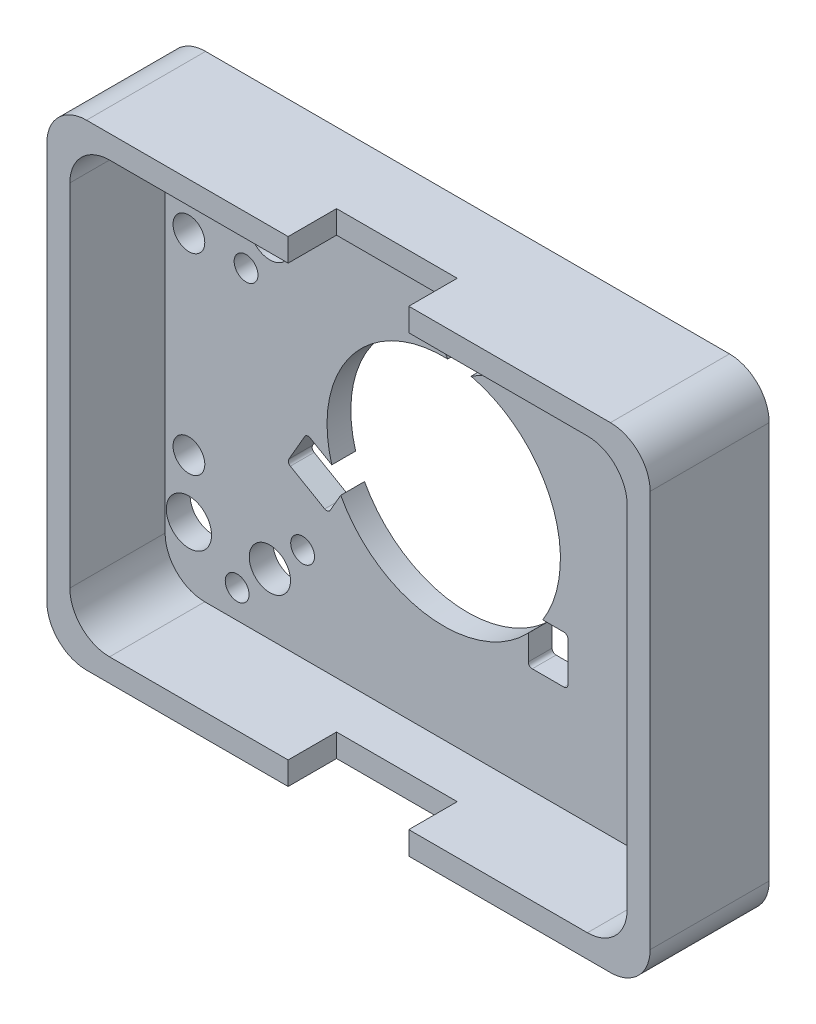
SolidWorks part; units mm, degrees
ref_plane "前基準面" through (0, 0, 0) normal (0, 0, 1) x (1, 0, 0)
ref_plane "上基準面" through (0, 0, 0) normal (0, 1, 0) x (1, 0, 0)
ref_plane "右基準面" through (0, 0, 0) normal (1, 0, 0) x (0, 0, -1)
sketch "草圖1" plane through (0, 0, 0) normal (0, 0, 1) x (1, 0, 0)
  line L1 (-33, 30) -> (33, 30)
  line L2 (-38, 25) -> (-38, -25)
  line L3 (-33, -30) -> (33, -30)
  line L4 (38, 25) -> (38, -25)
  line L5 (-38, 30) -> (38, -30) construction
  line L6 (-38, -30) -> (38, 30) construction
  arc A0 (-38, -25) -> (-33, -30) centre (-33, -25) ccw
  arc A1 (33, -30) -> (38, -25) centre (33, -25) ccw
  arc A2 (33, 30) -> (38, 25) centre (33, 25) cw
  arc A3 (-33, 30) -> (-38, 25) centre (-33, 25) ccw
  point P0 (0, 0)
  dimension "D3" = 5
  dimension "D1" = 76
  dimension "D2" = 60
extrude "填料-伸長1" add sketch "草圖1" along normal blind 15
sketch "草圖2" plane through (0, 0, 15) normal (0, 0, 1) x (1, 0, 0)
  line L0 (33, 30) -> (-33, 30) construction
  line L1 (-30.1, 27.1) -> (30.1, 27.1)
  line L2 (-35.1, 22.1) -> (-35.1, -22.1)
  line L3 (-30.1, -27.1) -> (30.1, -27.1)
  line L4 (35.1, 22.1) -> (35.1, -22.1)
  line L5 (-35.1, 27.1) -> (35.1, -27.1) construction
  line L6 (-35.1, -27.1) -> (35.1, 27.1) construction
  line L8 (-38, 25) -> (-38, -25) construction
  arc A0 (-35.1, -22.1) -> (-30.1, -27.1) centre (-30.1, -22.1) ccw
  arc A1 (30.1, -27.1) -> (35.1, -22.1) centre (30.1, -22.1) ccw
  arc A2 (30.1, 27.1) -> (35.1, 22.1) centre (30.1, 22.1) cw
  arc A3 (-30.1, 27.1) -> (-35.1, 22.1) centre (-30.1, 22.1) ccw
  point P0 (0, 0)
  dimension "D3" = 5
  dimension "D1" = 2.9
  dimension "D2" = 2.9
extrude "除料-伸長1" cut sketch "草圖2" against normal blind 12
sketch "草圖3" plane through (0, 0, 0) normal (0, 1, 0) x (1, 0, 0)
  line L0 (0, 11.6056) -> (0, -27.4941) construction
  line L1 (0, -3) -> (14.7, -3)
  line L2 (30.1, -3) -> (-30.1, -3) construction
  line L3 (14.7, -3) -> (14.7, -1.9)
  line L6 (0, -1.9) -> (0, -3)
  line L7 (14.7, -1.9) -> (14.7, 0)
  line L8 (33, 0) -> (-33, 0) construction
  line L9 (14.7, 0) -> (0, 0)
  line L10 (0, 0) -> (0, -1.9)
  dimension "D1" = 14.7
  dimension "D2" = 14.7
  dimension "D3" = 1.1
revolve "除料-旋轉1" cut sketch "草圖3" angle 360 about L0
ref_plane "平面1" through (0, 0, 15) normal (0, 0, 1) x (1, 0, 0)
sketch "草圖4" plane through (0, 0, 15) normal (0, 0, 1) x (1, 0, 0)
  line L0 (0, 32.9941) -> (0, -32.6269) construction
  line L1 (-42.1259, 0) -> (41.8506, 0) construction
  line L2 (7.6, 30) -> (-7.6, 30)
  line L3 (33, 30) -> (-33, 30) construction
  line L4 (-7.6, 30) -> (-7.6, 27.1)
  line L5 (30.1, 27.1) -> (-30.1, 27.1) construction
  line L6 (-7.6, 27.1) -> (7.6, 27.1)
  line L7 (30.1, 27.1) -> (-30.1, 27.1) construction
  line L8 (0, 27.1) -> (0, 30)
  line L9 (7.6, 30) -> (7.6, 27.1)
  line L10 (-7.6, -30) -> (-7.6, -27.1)
  line L11 (7.6, -30) -> (-7.6, -30)
  line L12 (7.6, -30) -> (7.6, -27.1)
  line L13 (-7.6, -27.1) -> (7.6, -27.1)
  dimension "D1" = 7.6
extrude "除料-伸長2" cut sketch "草圖4" against normal blind 6.1 contours L6 L9 L2 L4 | L11 L10 L13 L12
sketch "草圖5" plane through (0, 0, 3) normal (0, 0, 1) x (1, 0, 0)
  line L0 (0, 27.1) -> (0, -27.1) construction
  line L1 (30.1, 27.1) -> (-30.1, 27.1) construction
  line L2 (-7.6, -27.1) -> (7.6, -27.1) construction
  line L3 (-35.1, 0) -> (35.1, 0) construction
  line L4 (-35.1, 22.1) -> (-35.1, -22.1) construction
  line L5 (35.1, -22.1) -> (35.1, 22.1) construction
  line L6 (-35.1, 22.1) -> (-25.1, 22.1) construction
  line L7 (-25.1, 22.1) -> (-25.1, -22.1) construction
  line L8 (-25.1, -22.1) -> (-35.1, -22.1) construction
  line L9 (-35.1, 22.1) -> (-35.1, -22.1) construction
  line L10 (35.1, -22.1) -> (35.1, 22.1) construction
  line L11 (13.15, 0) -> (13.15, -16.56) construction
  line L12 (11.15, -8.28) -> (15.15, -8.28) construction
  line L13 (11.15, -7.78) -> (15.15, -7.78) construction
  line L14 (15.15, -7.78) -> (15.15, -8.78) construction
  line L15 (15.15, -8.78) -> (11.15, -8.78) construction
  line L16 (11.15, -8.78) -> (11.15, -7.78) construction
  line L17 (0, 0) -> (-14.4458, 25.0209) construction
  line L18 (-6.575, 11.3882) -> (6.9004, 19.1682) construction
  line L19 (-0.8373, 17.0103) -> (1.1627, 13.5462) construction
  line L20 (-0.8373, 17.0103) -> (0.0287, 17.5103) construction
  line L21 (0.0287, 17.5103) -> (2.0287, 14.0462) construction
  line L22 (2.0287, 14.0462) -> (1.1627, 13.5462) construction
  line L23 (-0.4043, 17.2603) -> (1.5957, 13.7962) construction
  line L24 (0, 0) -> (-14.6172, -25.3177) construction
  line L25 (-6.575, -11.3882) -> (-20.0504, -3.6082) construction
  line L30 (-12.3127, -5.7662) -> (-14.3127, -9.2303) construction
  line L31 (-12.3127, -5.7662) -> (-13.1787, -5.2662) construction
  line L32 (-13.1787, -5.2662) -> (-15.1787, -8.7303) construction
  line L33 (-15.1787, -8.7303) -> (-14.3127, -9.2303) construction
  line L34 (-12.7457, -5.5162) -> (-14.7457, -8.9803) construction
  line L35 (-17.5088, -2.7662) -> (-19.5088, -6.2303) construction
  line L36 (-19.5088, -6.2303) -> (-18.6428, -6.7303) construction
  line L37 (-16.6428, -3.2662) -> (-18.6428, -6.7303) construction
  line L38 (-16.6428, -3.2662) -> (-17.5088, -2.7662) construction
  line L39 (-17.0758, -3.0162) -> (-19.0758, -6.4803) construction
  line L40 (-19.3258, -6.9133) -> (-14.9957, -9.4133)
  line L41 (-16.8258, -2.5832) -> (-12.4957, -5.0832)
  line L42 (-17.5088, -2.7662) -> (-19.5088, -6.2303)
  line L43 (-12.3127, -5.7662) -> (-14.3127, -9.2303)
  line L44 (3.4928, 19.5103) -> (5.4928, 16.0462) construction
  line L45 (6.3588, 16.5462) -> (5.4928, 16.0462) construction
  line L46 (3.4928, 19.5103) -> (4.3588, 20.0103) construction
  line L47 (4.3588, 20.0103) -> (6.3588, 16.5462) construction
  line L48 (3.9258, 19.7603) -> (5.9258, 16.2962) construction
  line L49 (-0.6543, 17.6933) -> (3.6758, 20.1933)
  line L50 (6.1758, 15.8632) -> (1.8457, 13.3632)
  line L51 (4.3588, 20.0103) -> (6.3588, 16.5462)
  line L52 (-0.8373, 17.0103) -> (1.1627, 13.5462)
  line L53 (11.15, -13.78) -> (11.15, -12.78) construction
  line L54 (15.15, -13.78) -> (11.15, -13.78) construction
  line L55 (15.15, -12.78) -> (15.15, -13.78) construction
  line L56 (11.15, -12.78) -> (15.15, -12.78) construction
  line L57 (11.15, -13.28) -> (15.15, -13.28) construction
  line L58 (11.15, -7.78) -> (15.15, -7.78)
  line L59 (15.15, -13.78) -> (11.15, -13.78)
  line L60 (15.65, -8.28) -> (15.65, -13.28)
  line L61 (10.65, -8.28) -> (10.65, -13.28)
  circle A0 centre (-32.1, 19.4) radius 2.85
  circle A1 centre (32.1, 17.9) radius 2.85
  circle A2 centre (-32.1, -19.4) radius 2.85
  circle A3 centre (32.1, -19.4) radius 2.85
  circle A4 centre (11.15, -8.28) radius 0.5 construction
  circle A5 centre (15.15, -8.28) radius 0.5 construction
  circle A6 centre (-0.4043, 17.2603) radius 0.5 construction
  circle A7 centre (1.5957, 13.7962) radius 0.5 construction
  circle A8 centre (-12.7457, -5.5162) radius 0.5 construction
  circle A9 centre (-14.7457, -8.9803) radius 0.5 construction
  circle A10 centre (-19.0758, -6.4803) radius 0.5 construction
  circle A11 centre (-17.0758, -3.0162) radius 0.5 construction
  arc A12 (-16.8258, -2.5832) -> (-17.5088, -2.7662) centre (-17.0758, -3.0162) ccw
  arc A13 (-19.5088, -6.2303) -> (-19.3258, -6.9133) centre (-19.0758, -6.4803) ccw
  arc A14 (-14.9957, -9.4133) -> (-14.3127, -9.2303) centre (-14.7457, -8.9803) ccw
  arc A15 (-12.4957, -5.0832) -> (-12.3127, -5.7662) centre (-12.7457, -5.5162) cw
  circle A16 centre (3.9258, 19.7603) radius 0.5 construction
  circle A17 centre (5.9258, 16.2962) radius 0.5 construction
  arc A18 (-0.6543, 17.6933) -> (-0.8373, 17.0103) centre (-0.4043, 17.2603) ccw
  arc A19 (3.6758, 20.1933) -> (4.3588, 20.0103) centre (3.9258, 19.7603) cw
  arc A20 (6.3588, 16.5462) -> (6.1758, 15.8632) centre (5.9258, 16.2962) cw
  circle A21 centre (15.15, -13.28) radius 0.5 construction
  circle A22 centre (11.15, -13.28) radius 0.5 construction
  arc A23 (1.8457, 13.3632) -> (1.1627, 13.5462) centre (1.5957, 13.7962) cw
  arc A24 (11.15, -7.78) -> (10.65, -8.28) centre (11.15, -8.28) ccw
  arc A25 (10.65, -13.28) -> (11.15, -13.78) centre (11.15, -13.28) ccw
  arc A26 (15.15, -13.78) -> (15.65, -13.28) centre (15.15, -13.28) ccw
  arc A27 (15.65, -8.28) -> (15.15, -7.78) centre (15.15, -8.28) ccw
  circle A28 centre (-32.1, 12.1) radius 2
  circle A29 centre (32.1, 12.1) radius 2
  circle A30 centre (32.1, -12.1) radius 2
  circle A31 centre (-32.1, -12.1) radius 2
  point P35 (13.15, -8.28)
  point P38 (11.15, -8.28)
  point P50 (0.1627, 15.2782)
  point P62 (-13.3127, -7.4982)
  point P78 (-18.0758, -4.7482)
  point P96 (4.9258, 18.0282)
  point P106 (11.15, -13.28)
  point P112 (13.15, -13.28)
  dimension "D2" = 5.7
  dimension "D6" = 5.7
  dimension "D8" = 13.15
  dimension "D25" = 5
  dimension "D31" = 4
  dimension "D1" = 10
  dimension "D3" = 2.7
  dimension "D4" = 3
  dimension "D5" = 4.2
  dimension "D7" = 3
  dimension "D9" = 4
  dimension "D10" = 1
  dimension "D11" = 7.78
  dimension "D12" = 120
  dimension "D13" = 13.15
  dimension "D14" = 4
  dimension "D15" = 1
  dimension "D16" = 7.78
  dimension "D17" = 120
  dimension "D18" = 13.15
  dimension "D19" = 4
  dimension "D20" = 1
  dimension "D21" = 7.78
  dimension "D22" = 5
  dimension "D23" = 4
  dimension "D24" = 1
  dimension "D26" = 1
  dimension "D27" = 4
  dimension "D28" = 5
  dimension "D29" = 4
  dimension "D30" = 1
  dimension "D32" = 15
extrude "除料-伸長3" cut sketch "草圖5" against normal through all contours L31 A8 | L31 A8 | L20 A6 | L20 A6 | L22 A7 | L22 A7 | A20 L51 A19 L49 A18 L52 L50 M4 | A23 L50 L52 M4 | L40 A14 L43 L41 A12 L42 A13 M4 | A30 | A0 | A2 | A3 | A1 | L61 A25 L59 A26 L60 A27 L58 A24 | A28 | A31 | A29
sketch "草圖8" plane through (0, 0, 3) normal (0, 0, 1) x (1, 0, 0)
  line L0 (-30.1, -27.1) -> (30.1, -27.1) construction
  line L1 (30.1, 27.1) -> (-30.1, 27.1) construction
  line L2 (35.1, -22.1) -> (35.1, 22.1) construction
  line L3 (0, 27.1) -> (0, -27.1) construction
  line L4 (-7.6, 27.1) -> (7.6, 27.1) construction
  line L5 (-7.6, -27.1) -> (7.6, -27.1) construction
  circle A0 centre (-21.9, -19.4) radius 2.6
  circle A2 centre (21.9, 16.9) radius 2.6
  circle A3 centre (-21.9, 16.9) radius 2.6
  dimension "D2" = 5.2
  dimension "D3" = 10.2
  dimension "D5" = 5.2
  dimension "D1" = 7.7
  dimension "D4" = 13.2
extrude "除料-伸長4" cut sketch "草圖8" against normal through all
sketch "草圖9" plane through (0, 0, 0) normal (0, 0, -1) x (-1, 0, 0)
  line L0 (-21.9, 16.9) -> (21.9, 16.9) construction
  line L1 (21.9, 16.9) -> (21.9, -19.4) construction
  line L2 (0, 37.0703) -> (0, -36.0454) construction
  line L3 (17.7769, -15.2769) -> (26.0231, -23.5231) construction
  line L4 (-21.9, 23.8425) -> (-21.9, 16.9) construction
  circle A0 centre (-18.9, 21.9) radius 1.5
  circle A1 centre (-24.9, 11.9) radius 1.5
  circle A2 centre (24.9, 11.9) radius 1.5
  circle A3 centre (18.9, 21.9) radius 1.5
  circle A4 centre (17.7769, -15.2769) radius 1.5
  circle A5 centre (26.0231, -23.5231) radius 1.5
  dimension "D1" = 3
  dimension "D4" = 3
  dimension "D8" = 3
  dimension "D9" = 3
  dimension "D2" = 3
  dimension "D3" = 5
  dimension "D5" = 5
  dimension "D6" = 3
  dimension "D7" = 45
  dimension "D10" = 11.6619
extrude "除料-伸長5" cut sketch "草圖9" against normal up to next
